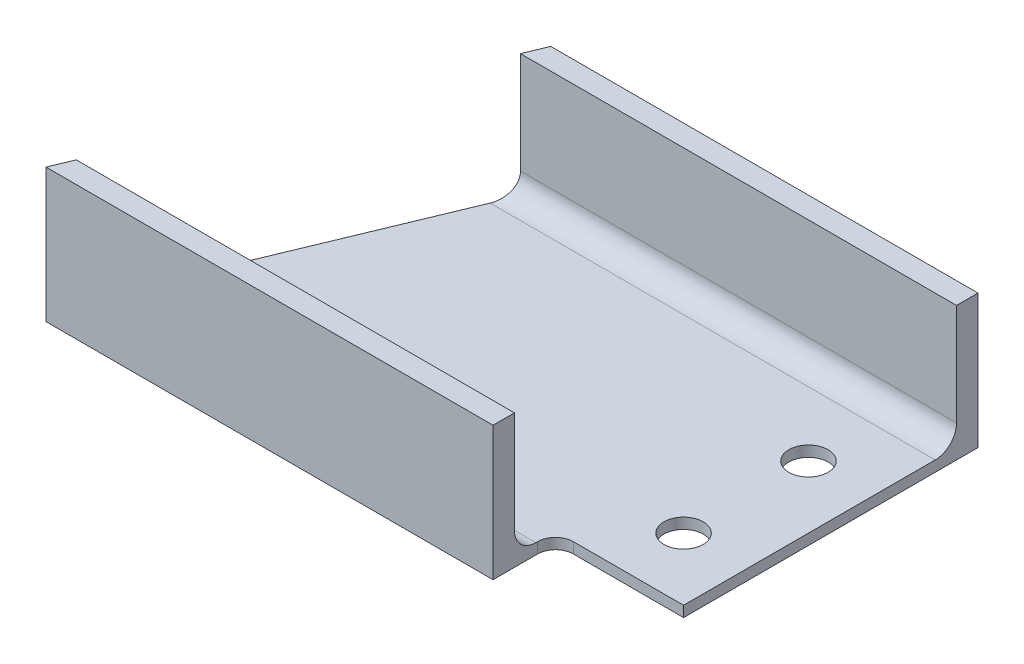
SolidWorks part; units mm, degrees
ref_plane "Front Plane" through (0, 0, 0) normal (0, 0, 1) x (1, 0, 0)
ref_plane "Top Plane" through (0, 0, 0) normal (0, 1, 0) x (1, 0, 0)
ref_plane "Right Plane" through (0, 0, 0) normal (1, 0, 0) x (0, 0, -1)
ref_plane "Member Plane" through (0, 0, 0) normal (0, 1, 0) x (-1, 0, 0)
sketch "Member Sketch" plane through (0, 0, 0) normal (0, 1, 0) x (1, 0, 0)
  line L0 (0, 0) -> (345, 0)
  line L2 (0, 0) -> (345, 0) construction
other "Structural Member1"
ref_plane "Plane1" through (0, 24.4, -100) normal (1, 0, 0) x (0, 1, 0)
sketch "Sketch11" plane through (0, 24.4, -100) normal (1, 0, 0) x (0, 1, 0)
  line L0 (-24.4, 100) -> (-24.4, -100)
  line L1 (0, 0) -> (-24.4, 0) construction
  line L2 (-24.4, 100) -> (50.6, 100)
  line L3 (50.6, 88) -> (-6.4, 88)
  line L4 (-18.4, 76) -> (-18.4, -76)
  line L5 (50.6, 100) -> (50.6, 88)
  line L6 (50.6, -100) -> (50.6, -88)
  line L7 (50.6, -88) -> (-6.4, -88)
  line L8 (-24.4, -100) -> (50.6, -100)
  line L9 (13.1, 100) -> (13.1, -100) construction
  line L10 (-24.4, 0) -> (50.6, 0) construction
  line L11 (50.6, 88) -> (50.6, -88) construction
  line L12 (0, 100) -> (0, -100) construction
  line L13 (20.6, 100) -> (20.6, -100) construction
  arc A0 (-18.4, -76) -> (-6.4, -88) centre (-6.4, -76) ccw
  arc A1 (-18.4, 76) -> (-6.4, 88) centre (-6.4, 76) cw
  circle A2 centre (20.6, 100) radius 1.5 construction
  circle A3 centre (20.6, -100) radius 1.5 construction
  circle A4 centre (20.6, 0) radius 1.5 construction
  point P10 (-18.4, 0)
  point P19 (-18.4, -100)
  point P20 (-24.4, -88)
  point P21 (-24.4, 88)
  point P22 (-18.4, 100)
  point P31 (13.1, 0)
  point P32 (0, 0)
  dimension "D1" = 3
  dimension "Root Radius(r1)" = 12
  dimension "Flange Thickness(T)" = 12
  dimension "Section Depth(D)" = 200
  dimension "Flange Width(B)" = 75
  dimension "Web Thickness(t)" = 6
  dimension "Centre of Area(XL)" = 24.4
  dimension "BackGuage" = 45
ref_plane "Plane2" through (0, 0, 0) normal (-0.9239, 0, -0.3827) x (-0.3827, 0, 0.9239)
other "Trim/Extend1"
other "0008-AABE002-CN02-FP03D02-1 - MEMBER2 CAVITY"
other "0008-AABE002<1>@0008-AA/0008-AABE002-CN02-FP03<1>@0008-AABE002/0008-AABE002-CN02-FP03D02<1>@0008-AABE002-CN02-FP031"
other "0008-AABE002-CN02-FP03D01-1 - MEMBER2 CAVITY"
other "0008-AABE002<1>@0008-AA/0008-AABE002-CN02-FP03<1>@0008-AABE002/0008-AABE002-CN02-FP03D01<1>@0008-AABE002-CN02-FP031"
